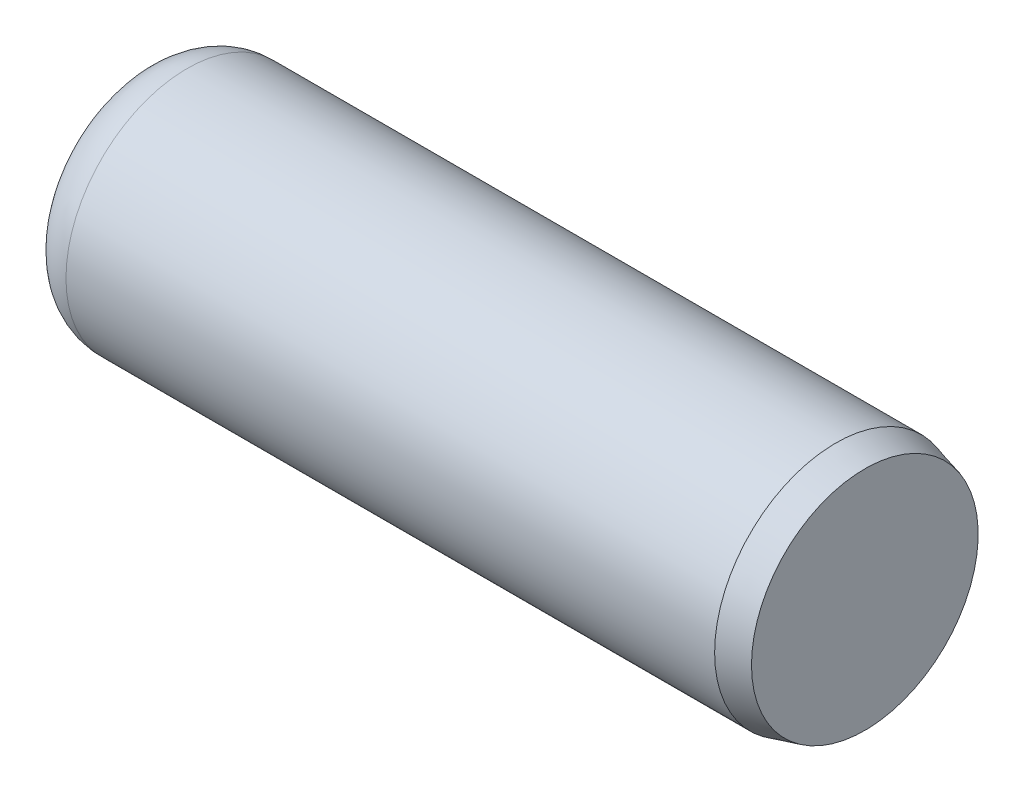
SolidWorks part; units mm, degrees
ref_plane "Plane1" through (0, 0, 0) normal (0, 0, 1) x (1, 0, 0)
ref_plane "Plane2" through (0, 0, 0) normal (0, 1, 0) x (1, 0, 0)
ref_plane "Plane3" through (0, 0, 0) normal (1, 0, 0) x (0, 0, -1)
sketch "Sketch1" plane through (0, 0, 0) normal (0, 0, 1) x (1, 0, 0)
  line L1 (-6.35, 0) -> (107.95, 0) construction
  line L2 (0, 0) -> (19.05, 0)
  line L3 (19.05, 0) -> (19.05, 2.9732)
  line L4 (19.05, 2.9732) -> (18.2874, 3.1775)
  line L5 (18.2874, 3.1775) -> (1.271, 3.1775)
  line L6 (0, 1.9065) -> (0, 0)
  arc A0 (1.271, 3.1775) -> (0, 1.9065) centre (1.271, 1.9065) ccw
  dimension "D4" = 1.271
  dimension "D2" = 0.7626
  dimension "D3" = 15
  dimension "Diameter" = 6.3551
  dimension "Length" = 19.05
revolve "Base-Revolve" add sketch "Sketch1" angle 360 about L1
equation "\"D4@Sketch1\" = \"Diameter@Sketch1\" * 0.2"
equation "\"D2@Sketch1\" = \"Diameter@Sketch1\" * 0.12"
equation "\"D3@Sketch1\" = 15.0"
